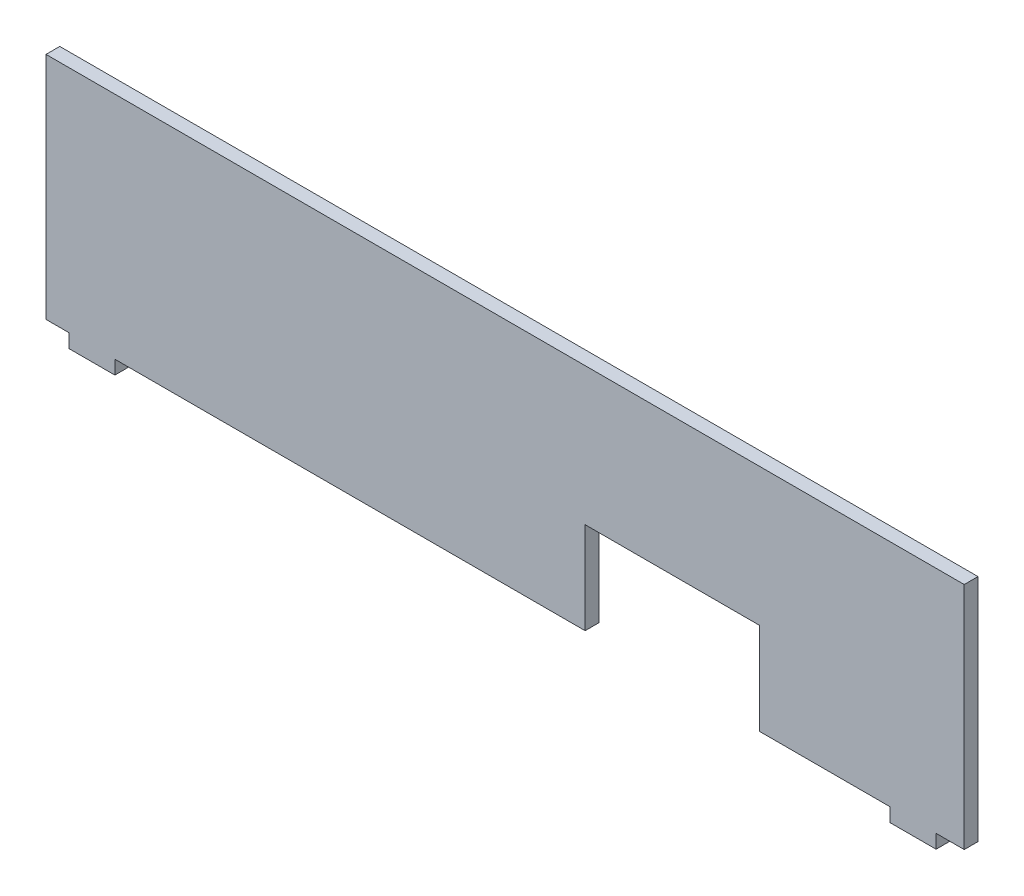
SolidWorks part; units mm, degrees
ref_plane "Plano frontal" through (0, 0, 0) normal (0, 0, 1) x (1, 0, 0)
ref_plane "Plano superior" through (0, 0, 0) normal (0, 1, 0) x (1, 0, 0)
ref_plane "Plano direito" through (0, 0, 0) normal (1, 0, 0) x (0, 0, -1)
sketch "Esboço2" plane through (0, 0, 0) normal (0, 0, 1) x (1, 0, 0)
  line L0 (-62.4907, 33.1346) -> (137.5093, 33.1346)
  line L1 (137.5093, 33.1346) -> (137.5093, -16.8654)
  line L3 (-62.4907, -16.8654) -> (-62.4907, 33.1346)
  line L4 (-62.4907, -16.8654) -> (-57.4907, -16.8654)
  line L5 (-57.4907, -16.8654) -> (-57.4907, -19.8654)
  line L6 (-57.4907, -19.8654) -> (-47.4907, -19.8654)
  line L7 (-47.4907, -19.8654) -> (-47.4907, -16.8654)
  line L8 (137.5093, -16.8654) -> (131.3793, -16.8654)
  line L9 (131.3793, -16.8654) -> (131.3793, -19.8654)
  line L10 (131.3793, -19.8654) -> (121.3793, -19.8654)
  line L11 (121.3793, -19.8654) -> (121.3793, -16.8654)
  line L14 (92.9397, -16.8654) -> (92.9397, 3.1346)
  line L15 (92.9397, 3.1346) -> (54.9397, 3.1346)
  line L16 (54.9397, 3.1346) -> (54.9397, -16.8654)
  line L17 (-47.4907, -16.8654) -> (54.9397, -16.8654)
  line L18 (92.9397, -16.8654) -> (121.3793, -16.8654)
extrude "Ressalto-extrusão2" add sketch "Esboço2" along normal blind 3
